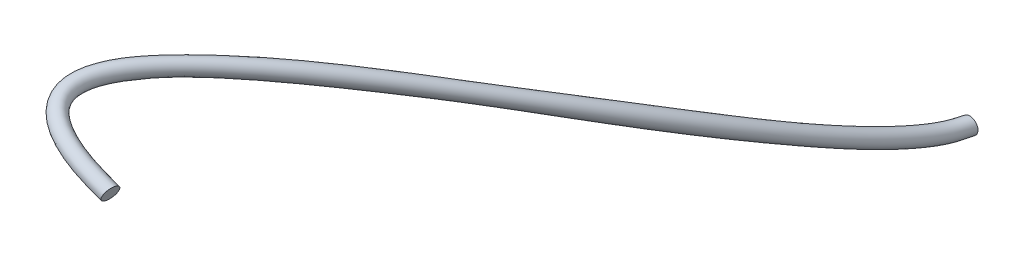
SolidWorks part; units mm, degrees
ref_plane "Płaszczyzna przednia" through (0, 0, 0) normal (0, 0, 1) x (1, 0, 0)
ref_plane "Płaszczyzna górna" through (0, 0, 0) normal (0, 1, 0) x (1, 0, 0)
ref_plane "Płaszczyzna prawa" through (0, 0, 0) normal (1, 0, 0) x (0, 0, -1)
sketch3d "Szkic 3D1"
  line L0 (0, 0, 0) -> (0, 0, 50) construction
  line L4 (0, 0, 50) -> (34.4645, 54.1491, 355.9895) construction
  line L5 (34.4645, 54.1491, 355.9895) -> (-500.9592, 85, 599) construction
  line L18 (-500.9592, 85, 599) -> (-226, 85, 599) construction
  circle A8 centre (-226, 85, 599) radius 7.5 construction
  spline_without_curve S0
  point P82 (-233.5, 85, 599)
  dimension "D1" = 750
  dimension "D2" = 50
sketch "Szkic2" plane through (0, 0, 0) normal (0, 0, 1) x (1, 0, 0)
  circle A0 centre (0, 0) radius 7.5
  dimension "D1" = 15
sweep "Wyciągnięcie po ścieżce1" add profiles "Szkic2" path "Szkic 3D1"
